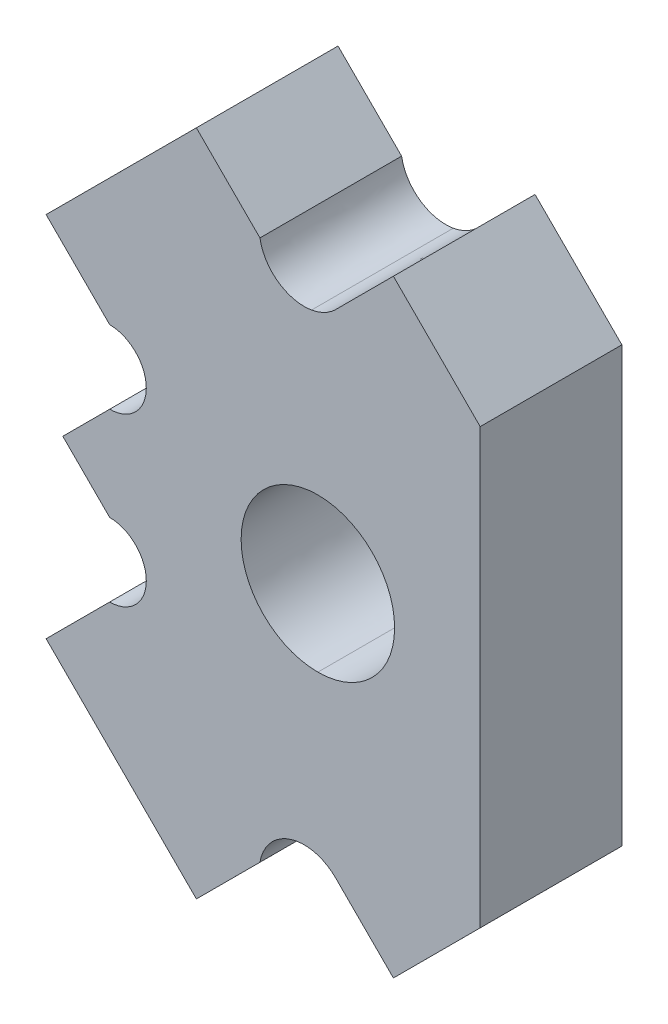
SolidWorks part; units mm, degrees
ref_plane "Plan de face" through (0, 0, 0) normal (0, 0, 1) x (1, 0, 0)
ref_plane "Plan de dessus" through (0, 0, 0) normal (0, 1, 0) x (1, 0, 0)
ref_plane "Plan de droite" through (0, 0, 0) normal (1, 0, 0) x (0, 0, -1)
body saved out of another part "Stock-Pièce3-1"
